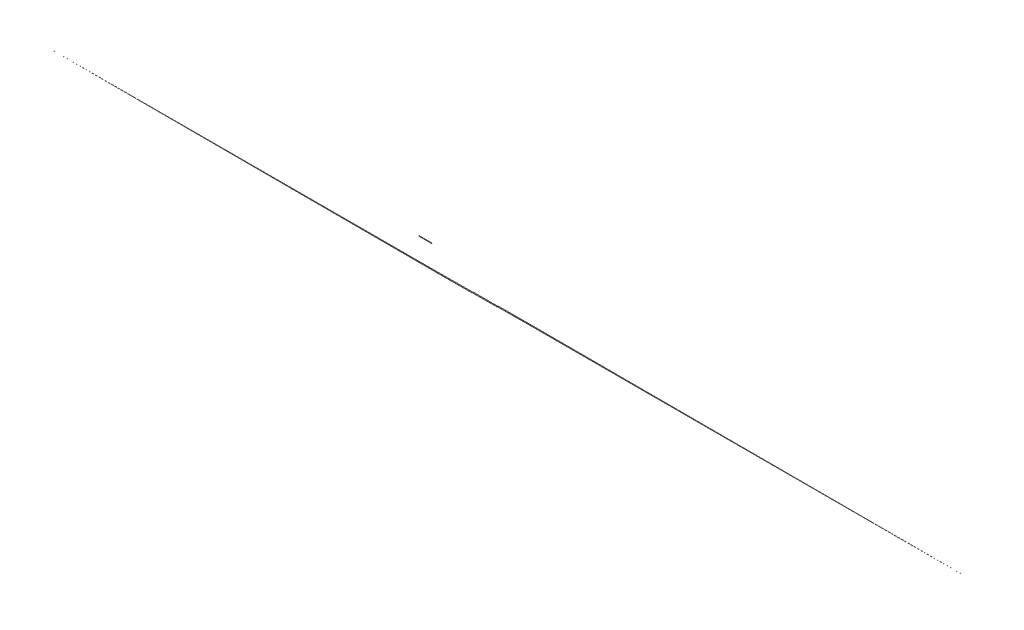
SolidWorks part; units mm, degrees
ref_plane "Front" through (0, 0, 0) normal (0, 0, 1) x (1, 0, 0)
ref_plane "Top" through (0, 0, 0) normal (0, 1, 0) x (1, 0, 0)
ref_plane "Right" through (0, 0, 0) normal (1, 0, 0) x (0, 0, -1)
sketch "Esquisse1" plane through (0, 0, 0) normal (0, 0, 1) x (1, 0, 0)
  line L0 (0, 0) -> (-29330, 0) construction
  line L1 (-29330, 0) -> (-31577.0426, -9.5725) construction
  line L2 (-31577.0426, -9.5725) -> (-31576.9574, -29.5725) construction
  line L3 (-31576.9574, -29.5725) -> (-33219.0319, -36.5677) construction
  line L4 (-33219.0319, -36.5677) -> (-33218.9681, -51.5676) construction
  line L5 (-33218.9681, -51.5676) -> (-35634, -61.8557) construction
  line L6 (-35634, -61.8557) -> (-61263, -61.8557) construction
  line L7 (0, 0) -> (-29328, 2.9328)
  line L8 (-29328, 2.9328) -> (-29328, -2.9328)
  line L9 (-29328, -2.9328) -> (0, 0)
  line L10 (-31567, -12.686) -> (-29332, -2.9413)
  line L11 (-29332, -2.9413) -> (-29332.025, 2.9242)
  line L12 (-29332.025, 2.9242) -> (-31567.0269, -6.3735)
  line L13 (-31567.0269, -6.3735) -> (-31567, -12.686)
  line L14 (-31587, -32.7716) -> (-31587.0269, -26.459)
  line L15 (-31587.0269, -26.459) -> (-33209, -33.2065)
  line L16 (-33209, -33.2065) -> (-33208.9717, -39.8434)
  line L17 (-33208.9717, -39.8434) -> (-31587, -32.7716)
  line L18 (-33229, -54.9289) -> (-33229.0283, -48.2919) construction
  line L19 (-33229.0283, -48.2919) -> (-61263, -171.0359) construction
  line L20 (-61263, -171.0359) -> (-33229, -54.9289) construction
  line L21 (-61263, -61.8557) -> (-61263, 66.6701) construction
  line L22 (-33229, -54.9289) -> (-33229.0283, -48.2919)
  line L23 (-33229.0283, -48.2919) -> (-35632.0259, -58.8132)
  line L24 (-35632.0259, -58.8132) -> (-35632, -64.8813)
  line L25 (-35632, -64.8813) -> (-33229, -54.9289)
  line L26 (-61263, -61.8557) -> (-35636, -58.8217)
  line L27 (-35636, -58.8217) -> (-35636, -64.8897)
  line L28 (-35636, -64.8897) -> (-61263, -61.8557)
  line L29 (0, 1400) -> (-59892.698, 1400) construction
  point P5 (-33219, -44.0677)
  point P11 (-31577, -19.5725)
  dimension "D1" = 61263
  dimension "D2" = 29330
  dimension "D3" = 31577
  dimension "D4" = 20
  dimension "D5" = 33219
  dimension "D6" = 90
  dimension "D7" = 90
  dimension "D8" = 0.244
  dimension "D9" = 15
  dimension "D10" = 35634
  dimension "D11" = 0.244
  dimension "D12" = 2
  dimension "D13" = 0.011
  dimension "D14" = 4
  dimension "D15" = 0.011
  dimension "D16" = 10
  dimension "D17" = 10
  dimension "D18" = 0.011
  dimension "D19" = 10
  dimension "D20" = 20
  dimension "D21" = 2
  dimension "D22" = 4
  dimension "D23" = 1400
  dimension "D24" = 1461.8557
  dimension "D25" = 1409.5725
  dimension "D26" = 1461.8557
  dimension "D27" = 1409.5725
  dimension "D28" = 1436.5677
  dimension "D30" = 1451.5676
  dimension "D31" = 1461.8557
extrude "Boss.-Extru.1" add sketch "Esquisse1" along normal mid plane 150
sketch "Esquisse2" plane through (0, 0, 0) normal (0, 1, 0) x (1, 0, 0)
  line L0 (0, 0) -> (-33219, 33.219)
  line L1 (-33219, 33.219) -> (-61263, 0)
  line L2 (-61263, -75) -> (-61263, 75) construction
  line L3 (-61263, 0) -> (-33219, -33.219)
  line L4 (-33219, -33.219) -> (0, 0)
  line L5 (0, 0) -> (-61263, 0) construction
  line L6 (-33219, 33.219) -> (-33219, -33.219) construction
  line L7 (-35636, 75) -> (-61263, 75) construction
  line L8 (-61273, 85) -> (10, 85)
  line L9 (-61273, 85) -> (-61273, -85)
  line L10 (-61273, -85) -> (10, -85)
  line L11 (10, 85) -> (10, -85)
  line L12 (-33229, -75) -> (-35632, -75) construction
  line L13 (0, -75) -> (0, 75) construction
  point P3 (-33219, 0)
  dimension "D1" = 0.115
  dimension "D2" = 10
  dimension "D3" = 10
  dimension "D4" = 10
  dimension "D5" = 10
extrude "Enlèv. mat.-Extru.1" cut sketch "Esquisse2" against normal through all and the other way through all
sketch "Esquisse3" plane through (0, 0, 0) normal (0, 0, 1) x (1, 0, 0)
  line L0 (0, 1400) -> (-59892.698, 1400) construction
  line L1 (-36752.2624, 1400) -> (-35897.7132, 1400)
  line L2 (-36752.2624, 1400) -> (-36752.2624, 1431.0775)
  line L3 (-36752.2624, 1431.0775) -> (-35897.7132, 1431.0775)
  line L4 (-35897.7132, 1400) -> (-35897.7132, 1431.0775)
extrude "Boss.-Extru.2" add sketch "Esquisse3" along normal mid plane 10 separate body
scale "Echelle1" [suppressed]
sketch "Esquisse4" plane through (0, 0, 0) normal (0, 0, 1) x (1, 0, 0)
  line L0 (-33218.9681, -51.5676) -> (-35634, -61.8557) construction
  line L1 (-35634, -61.8557) -> (-61263, -61.8557) construction
  line L2 (-33218.9681, -51.5676) -> (-35634, -61.8557)
  line L3 (-35634, -61.8557) -> (-61263, -61.8557)
  line L4 (-29330, 0) -> (-31577.0426, -9.5725) construction
  line L5 (0, 0) -> (-29330, 0) construction
  line L6 (-29330, 0) -> (-31577.0426, -9.5725)
  line L7 (0, 0) -> (-29330, 0)
  dimension "D1" = 0.244
  dimension "D2" = 0.244
equation "\"éà\"=24.0271"
